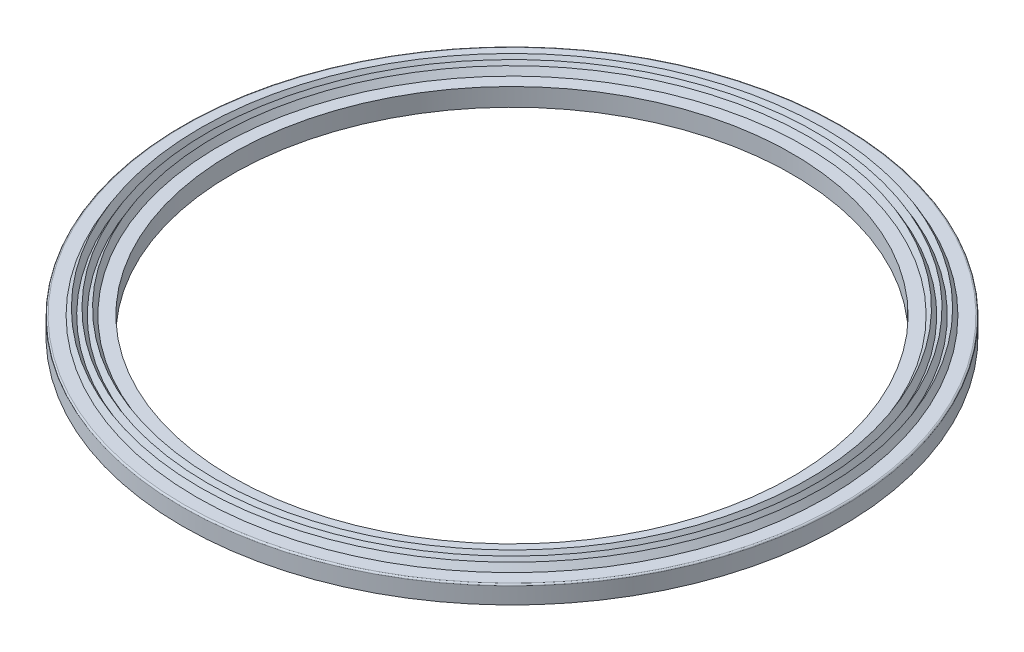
SolidWorks part; units mm, degrees
ref_plane "Plan de face" through (0, 0, 0) normal (0, 0, 1) x (1, 0, 0)
ref_plane "Plan de dessus" through (0, 0, 0) normal (0, 1, 0) x (1, 0, 0)
ref_plane "Plan de droite" through (0, 0, 0) normal (1, 0, 0) x (0, 0, -1)
sketch "Esquisse1" plane through (0, 0, 0) normal (0, 0, 1) x (1, 0, 0)
  line L0 (0, 87.6488) -> (0, -87.8567) construction
  line L1 (-93.5, 55.9825) -> (-97.75, 55.9825)
  line L2 (-93.5, 55.9825) -> (-93.5, 53.9825)
  line L3 (-110, 55.4825) -> (-110, 49.9825)
  line L4 (-104, 59.8568) -> (-104, 52.3579) construction
  line L5 (-99, 59.8568) -> (-99, 52.3579) construction
  line L6 (-99, 58.1125) -> (-97.75, 55.9825)
  line L7 (-99, 58.1125) -> (-100.25, 55.9825)
  line L8 (-102.75, 59.8568) -> (-102.75, 52.3579) construction
  line L9 (-101.5, 59.8568) -> (-101.5, 53.3638) construction
  line L10 (-100.25, 59.8568) -> (-100.25, 53.3638) construction
  line L11 (-100.25, 55.9825) -> (-101.5, 58.1125)
  line L12 (-101.5, 58.1125) -> (-102.75, 55.9825)
  line L13 (-102.75, 55.9825) -> (-104, 58.1125)
  line L14 (-104, 58.1125) -> (-105.25, 55.9825)
  line L15 (-109.7619, 58.1125) -> (-96.7211, 58.1125) construction
  line L16 (-110, 49.9825) -> (-109, 49.9825)
  line L17 (-109, 49.9825) -> (-109, 53.9825)
  line L18 (-93.5, 49.9825) -> (-93.5, 53.9825)
  line L19 (-109, 53.9825) -> (-95.5, 53.9825)
  line L20 (-95.5, 53.9825) -> (-95.5, 49.9825)
  line L21 (-95.5, 49.9825) -> (-93.5, 49.9825)
  line L22 (-105.25, 55.9825) -> (-109.5, 55.9825)
  arc A0 (-110, 55.4825) -> (-109.5, 55.9825) centre (-109.5, 55.4825) cw
  point P21 (-110, 55.9825)
  dimension "D5" = 0.5
  dimension "D1" = 93.5
  dimension "D2" = 110
  dimension "D3" = 8.13
  dimension "D4" = 5.5
  dimension "D6" = 2.5
  dimension "D7" = 1.25
  dimension "D8" = 2.5
  dimension "D9" = 1.25
  dimension "D10" = 1.25
  dimension "D11" = 2.13
  dimension "D12" = 4
  dimension "D13" = 1
  dimension "D14" = 2
revolve "Révolution1" add sketch "Esquisse1" angle 360 about L0
